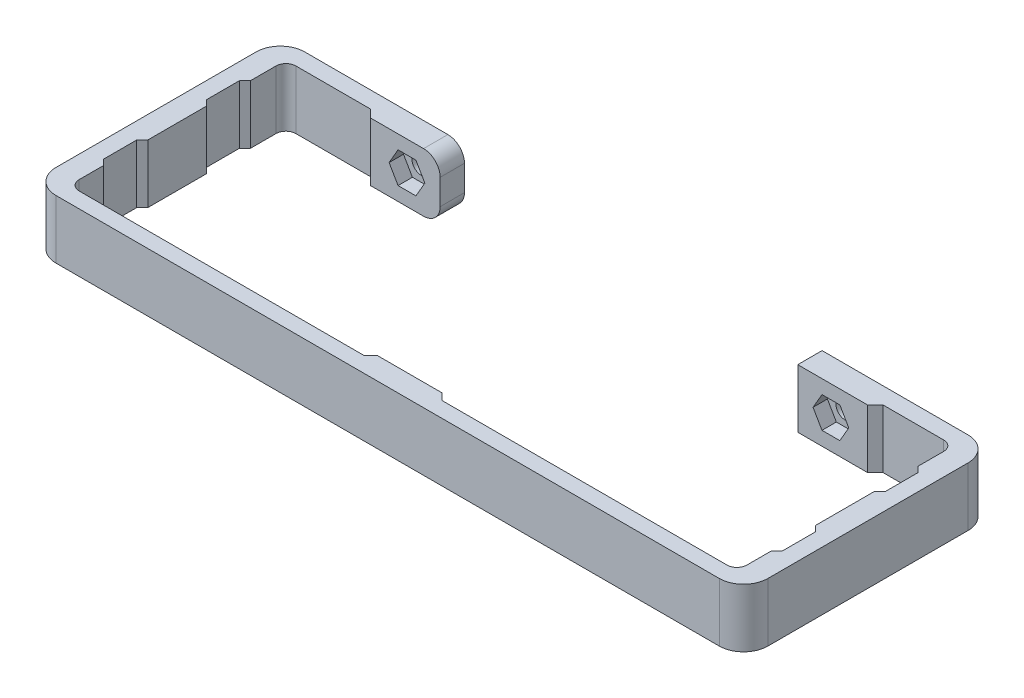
SolidWorks part; units mm, degrees
ref_plane "Front Plane" through (0, 0, 0) normal (0, 0, 1) x (1, 0, 0)
ref_plane "Top Plane" through (0, 0, 0) normal (0, 1, 0) x (1, 0, 0)
ref_plane "Right Plane" through (0, 0, 0) normal (1, 0, 0) x (0, 0, -1)
sketch "Sketch1" plane through (0, 0, 0) normal (0, 0, 1) x (1, 0, 0)
  line L1 (-7.4026, 47.8166) -> (121.3974, 47.8166)
  line L2 (-7.4026, 47.8166) -> (-7.4026, 37.2166)
  line L3 (-7.4026, 37.2166) -> (121.3974, 37.2166)
  line L4 (121.3974, 47.8166) -> (121.3974, 37.2166)
  dimension "D1" = 128.8
  dimension "D2" = 10.6
extrude "Boss-Extrude1" add sketch "Sketch1" along normal blind 4
ref_plane "Plane1" through (0, 0, 0) normal (0, 0, -1) x (-1, 0, 0)
sketch "Sketch2" plane through (0, 0, 0) normal (0, 0, -1) x (-1, 0, 0)
  line L0 (-121.3974, 47.8166) -> (7.4026, 47.8166) construction
  line L1 (-121.3974, 37.2166) -> (-117.3974, 37.2166)
  line L2 (-121.3974, 37.2166) -> (-121.3974, 47.8166)
  line L3 (-121.3974, 47.8166) -> (-117.3974, 47.8166)
  line L4 (-117.3974, 37.2166) -> (-117.3974, 47.8166)
  line L6 (7.4026, 37.2166) -> (3.4026, 37.2166)
  line L7 (7.4026, 37.2166) -> (7.4026, 47.8166)
  line L8 (7.4026, 47.8166) -> (3.4026, 47.8166)
  line L9 (3.4026, 37.2166) -> (3.4026, 47.8166)
  dimension "D1" = 4
  dimension "D2" = 4
extrude "Boss-Extrude2" add sketch "Sketch2" along normal blind 41
ref_plane "Plane2" through (0, 47.8166, 0) normal (0, 1, 0) x (1, 0, 0)
sketch "Sketch3" plane through (0, 47.8166, 0) normal (0, 1, 0) x (1, 0, 0)
  line L1 (-3.4026, 41) -> (25.8974, 41)
  line L2 (-3.4026, 41) -> (-3.4026, 36.6)
  line L3 (-3.4026, 36.6) -> (25.8974, 36.6)
  line L4 (25.8974, 41) -> (25.8974, 36.6)
  line L5 (117.3974, 41) -> (90.5974, 41)
  line L6 (117.3974, 41) -> (117.3974, 36.6)
  line L7 (117.3974, 36.6) -> (90.5974, 36.6)
  line L8 (90.5974, 41) -> (90.5974, 36.6)
  dimension "D1" = 4.4
  dimension "D2" = 4.4
  dimension "D3" = 29.3
  dimension "D4" = 26.8
extrude "Boss-Extrude3" add sketch "Sketch3" against normal blind 10.6
fillet "Fillet1" radius 4.4 4 edges at (121.3974, 42.5166, -41) (-7.4026, 42.5166, -41) (-7.4026, 42.5166, 4) (121.3974, 42.5166, 4)
ref_plane "Plane3" through (0, 0, -41) normal (0, 0, -1) x (-1, 0, 0)
sketch "Sketch4" plane through (0, 0, -41) normal (0, 0, -1) x (-1, 0, 0)
  line L0 (-25.8974, 37.2166) -> (-25.8974, 47.8166) construction
  line L1 (3.0026, 47.8166) -> (-25.8974, 47.8166) construction
  line L2 (-90.5974, 47.8166) -> (-116.9974, 47.8166) construction
  line L3 (-90.5974, 37.2166) -> (-90.5974, 47.8166) construction
  circle A0 centre (-19.8974, 42.5166) radius 1.7
  circle A1 centre (-96.5974, 42.5166) radius 1.7
  dimension "D1" = 3.4
  dimension "D2" = 3.4
  dimension "D3" = 6
  dimension "D4" = 5.3
  dimension "D5" = 5.3
  dimension "D6" = 6
extrude "Cut-Extrude1" cut sketch "Sketch4" against normal blind 10.6
ref_plane "Plane4" through (0, 0, -36.6) normal (0, 0, 1) x (1, 0, 0)
sketch "Sketch5" plane through (0, 0, -36.6) normal (0, 0, 1) x (1, 0, 0)
  line L1 (21.514, 39.7166) -> (23.1305, 42.5166)
  line L2 (23.1305, 42.5166) -> (21.514, 45.3166)
  line L3 (21.514, 45.3166) -> (18.2808, 45.3166)
  line L4 (18.2808, 45.3166) -> (16.6642, 42.5166)
  line L5 (16.6642, 42.5166) -> (18.2808, 39.7166)
  line L6 (18.2808, 39.7166) -> (21.514, 39.7166)
  line L7 (98.214, 39.7166) -> (99.8305, 42.5166)
  line L8 (99.8305, 42.5166) -> (98.214, 45.3166)
  line L9 (98.214, 45.3166) -> (94.9808, 45.3166)
  line L10 (94.9808, 45.3166) -> (93.3642, 42.5166)
  line L11 (93.3642, 42.5166) -> (94.9808, 39.7166)
  line L12 (94.9808, 39.7166) -> (98.214, 39.7166)
  circle A0 centre (19.8974, 42.5166) radius 2.8 construction
  circle A1 centre (96.5974, 42.5166) radius 2.8 construction
  dimension "D1" = 5.6
  dimension "D2" = 5.6
extrude "Cut-Extrude2" cut sketch "Sketch5" against normal blind 2.6
sketch "Sketch6" plane through (0, 47.8166, 0) normal (0, 1, 0) x (1, 0, 0)
  line L0 (121.3974, 0.4) -> (121.3974, 36.6) construction
  line L1 (117.3974, 4) -> (118.3974, 4)
  line L2 (117.3974, 4) -> (117.3974, 14)
  line L3 (117.3974, 14) -> (118.3974, 14)
  line L4 (118.3974, 4) -> (118.3974, 14)
  line L5 (117.3974, 32.6) -> (118.3974, 32.6)
  line L6 (117.3974, 32.6) -> (117.3974, 22.6)
  line L7 (117.3974, 22.6) -> (118.3974, 22.6)
  line L8 (118.3974, 32.6) -> (118.3974, 22.6)
  line L9 (117.3974, 36.6) -> (117.3974, 0) construction
  line L10 (-3.4026, 4) -> (-4.4026, 4)
  line L11 (-3.4026, 4) -> (-3.4026, 14)
  line L12 (-3.4026, 14) -> (-4.4026, 14)
  line L13 (-4.4026, 4) -> (-4.4026, 14)
  line L14 (-3.4026, 32.6) -> (-4.4026, 32.6)
  line L15 (-3.4026, 32.6) -> (-3.4026, 22.6)
  line L16 (-3.4026, 22.6) -> (-4.4026, 22.6)
  line L17 (-4.4026, 32.6) -> (-4.4026, 22.6)
  line L18 (-3.4026, 36.6) -> (-3.4026, 0) construction
  line L19 (117.3974, 0) -> (-3.4026, 0) construction
  line L20 (90.5974, 36.6) -> (117.3974, 36.6) construction
  line L21 (-7.4026, 0.4) -> (-7.4026, 36.6) construction
  line L22 (-3.4026, 36.6) -> (25.8974, 36.6) construction
  point P32 (117.8974, 4)
  dimension "D1" = 3
  dimension "D2" = 3
  dimension "D3" = 4
  dimension "D4" = 10
  dimension "D5" = 4
  dimension "D6" = 10
  dimension "D7" = 4
  dimension "D8" = 3
  dimension "D9" = 3
  dimension "D10" = 4
  dimension "D11" = 10
  dimension "D12" = 10
extrude "Cut-Extrude3" cut sketch "Sketch6" against normal blind 13.6
sketch "Sketch7" plane through (0, 47.8166, 0) normal (0, 1, 0) x (1, 0, 0)
  line L0 (116.9974, -4) -> (-3.0026, -4) construction
  line L1 (117.3974, 0) -> (61.9974, 0)
  line L2 (117.3974, 0) -> (117.3974, -1.2)
  line L3 (117.3974, -1.2) -> (61.9974, -1.2)
  line L4 (61.9974, 0) -> (61.9974, -1.2)
  line L5 (-3.4026, 0) -> (51.9974, 0)
  line L6 (-3.4026, 0) -> (-3.4026, -1.2)
  line L7 (-3.4026, -1.2) -> (51.9974, -1.2)
  line L8 (51.9974, 0) -> (51.9974, -1.2)
  line L9 (-3.0026, 41) -> (25.8974, 41) construction
  line L10 (117.3974, 36.6) -> (102.5974, 36.6)
  line L11 (117.3974, 36.6) -> (117.3974, 38)
  line L12 (117.3974, 38) -> (102.5974, 38)
  line L13 (102.5974, 36.6) -> (102.5974, 38)
  line L14 (-3.4026, 36.6) -> (13.8974, 36.6)
  line L15 (-3.4026, 36.6) -> (-3.4026, 38)
  line L16 (-3.4026, 38) -> (13.8974, 38)
  line L17 (13.8974, 36.6) -> (13.8974, 38)
  line L18 (90.5974, 41) -> (116.9974, 41) construction
  line L19 (90.5974, 41) -> (90.5974, 36.6) construction
  line L20 (25.8974, 36.6) -> (25.8974, 41) construction
  point P26 (102.5974, 37.3)
  point P31 (25.8974, 38.8)
  dimension "D1" = 10
  dimension "D2" = 55.4
  dimension "D3" = 2.8
  dimension "D4" = 2.8
  dimension "D5" = 3
  dimension "D6" = 3
  dimension "D7" = 12
  dimension "D8" = 12
extrude "Cut-Extrude4" cut sketch "Sketch7" against normal blind 13.6
chamfer "Chamfer1" distance 2 angle 45 12 edges at (102.5974, 42.5166, -38) (13.8974, 42.5166, -38) (118.3974, 42.5166, -32.6) (118.3974, 42.5166, -4) (118.3974, 42.5166, -14) (118.3974, 42.5166, -22.6) (61.9974, 42.5166, 1.2) (51.9974, 42.5166, 1.2) (-4.4026, 42.5166, -14) (-4.4026, 42.5166, -4) (-4.4026, 42.5166, -22.6) (-4.4026, 42.5166, -32.6)
fillet "Fillet2" radius 1.8 4 edges at (117.3974, 42.5166, -38) (117.3974, 42.5166, 1.2) (-3.4026, 42.5166, -38) (-3.4026, 42.5166, 1.2)
fillet "Fillet3" radius 3 2 edges at (25.8974, 47.8166, -38.8) (25.8974, 37.2166, -38.8)
